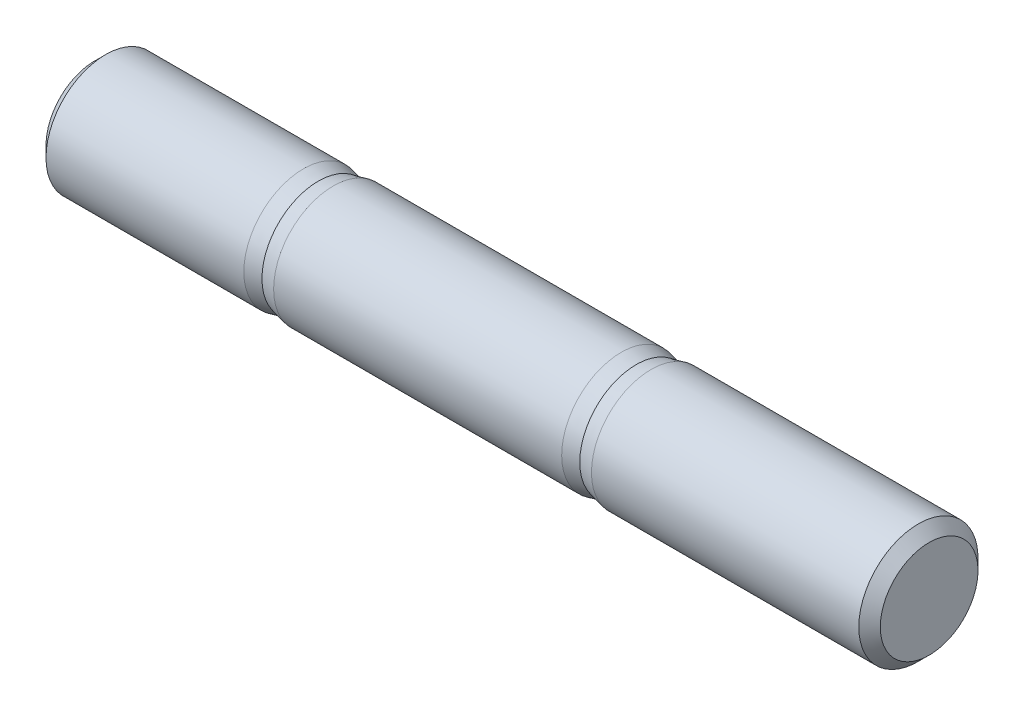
SolidWorks part; units mm, degrees
ref_plane "Front" through (0, 0, 0) normal (0, 0, 1) x (1, 0, 0)
ref_plane "Top" through (0, 0, 0) normal (0, 1, 0) x (1, 0, 0)
ref_plane "Right" through (0, 0, 0) normal (1, 0, 0) x (0, 0, -1)
sketch "Sketch1" plane through (0, 0, 0) normal (0, 0, 1) x (1, 0, 0)
  line L0 (-1.3108, 0) -> (30.3862, 0) construction
  line L1 (0, 0) -> (0, 3)
  line L2 (0, 3) -> (10.5, 3)
  line L3 (10.5, 3) -> (12, 2.675)
  line L4 (12, 2.675) -> (26.5, 2.675)
  line L5 (26.5, 2.675) -> (28, 3)
  line L6 (28, 3) -> (42, 3)
  line L7 (42, 3) -> (42, 0)
  line L8 (42, 0) -> (0, 0)
  dimension "X" = 1.5
  dimension "D2" = 1.5
  dimension "bm" = 12
  dimension "b" = 14
  dimension "l" = 30
  dimension "d" = 6
  dimension "ds" = 5.35
revolve "BaseHead" add sketch "Sketch1" angle 360 about L0
chamfer "HeadChamfer" distance 0.5415 angle 45 2 edges at (42, 0, 3) (0, 0, 3)
sketch "Sketch2" plane through (0, 0, 0) normal (0, 0, 1) x (1, 0, 0)
  line L0 (-1.3108, 0) -> (31.2107, 0) construction
  line L2 (10.5, 2.675) -> (12, 3)
  line L3 (12, 3) -> (26.5, 3)
  line L4 (26.5, 3) -> (28, 2.675)
  line L7 (10.5, 3) -> (10.5, -3) construction
  line L9 (10.5, 2.675) -> (28, 2.675)
  line L10 (28, 3) -> (28, -3) construction
  dimension "D1" = 1.5
  dimension "D2" = 6
revolve "BaseBody" add sketch "Sketch2" angle 360 about L0
sketch "Sketch3" plane through (0, 0, 0) normal (0, 0, 1) x (1, 0, 0)
  line L0 (41.4585, 2.531) -> (41.7292, 3)
  line L1 (41.7292, 3) -> (41.7292, 3.5)
  line L2 (41.7292, 3.5) -> (41.1877, 3.5)
  line L3 (41.1877, 3.5) -> (41.1877, 3)
  line L4 (41.1877, 3) -> (41.4585, 2.531)
  line L5 (0, 0) -> (53.3681, 0) construction
  line L6 (0, 2.4585) -> (0, -2.4585) construction
  line L7 (41.4585, 3) -> (41.4585, -3) construction
  dimension "D1" = 0.5
  dimension "D2" = 0.5415
  dimension "D3" = 60
  dimension "D4" = 60
  dimension "D5" = 6
revolve "Cut-Revolve10" [suppressed] cut sketch "Sketch3" angle 360 about L5
pattern_linear "LPattern10" [suppressed] count 22 spacing 0.6498 along (1, 0, 0)
sketch "Sketch4" plane through (0, 0, 0) normal (0, 1, 0) x (1, 0, 0)
  line L0 (0.5415, 2.531) -> (0.8123, 3)
  line L1 (0.8123, 3) -> (0.8123, 3.5)
  line L2 (0.8123, 3.5) -> (0.2708, 3.5)
  line L3 (0.2708, 3.5) -> (0.2708, 3)
  line L4 (0.2708, 3) -> (0.5415, 2.531)
  line L5 (0, 0) -> (3.4199, 0) construction
  line L6 (0.5415, 3) -> (0.5415, -3) construction
  dimension "D1" = 60
  dimension "D2" = 0.5
  dimension "D3" = 0.5415
  dimension "D4" = 60
  dimension "D5" = 6
revolve "Cut-Revolve11" [suppressed] cut sketch "Sketch4" angle 360 about L5
pattern_linear "LPattern11" [suppressed] count 16 spacing 0.6498 along (1, 0, 0)
equation "\"D2@Sketch1\" = \"X@Sketch1\""
equation "\"D2@ThreadCosmetic2\" = \"D2@ThreadCosmetic1\""
equation "\"D1@ThreadCosmetic1\" = \"bm@Sketch1\"-\"X@Sketch1\""
equation "\"b@ThreadCosmetic2\" = \"b@Sketch1\""
equation "\"D1@Sketch2\" = \"X@Sketch1\""
equation "\"D2@Sketch2\" = \"d@Sketch1\""
equation "\"D1@HeadChamfer\" =  (\"d@Sketch1\" - \"D2@ThreadCosmetic1\" )  / 2"
equation "\"D5@Sketch3\" = \"d@Sketch1\""
equation "\"D2@Sketch3\" =  ( \"d@Sketch1\" - \"D2@ThreadCosmetic2\" )  / 2"
equation "\"D3@LPattern10\" = \"D2@Sketch3\" * 1.2"
equation "\"D1@LPattern10\" = \"b@ThreadCosmetic2\" / \"D3@LPattern10\""
equation "\"D5@Sketch4\" = \"d@Sketch1\""
equation "\"D3@Sketch4\" = (  \"d@Sketch1\" - \"D2@ThreadCosmetic1\" )  / 2"
equation "\"D3@LPattern11\" = \"D3@Sketch4\" * 1.2"
equation "\"D1@LPattern11\" = \"D1@ThreadCosmetic1\" / \"D3@LPattern11\""
